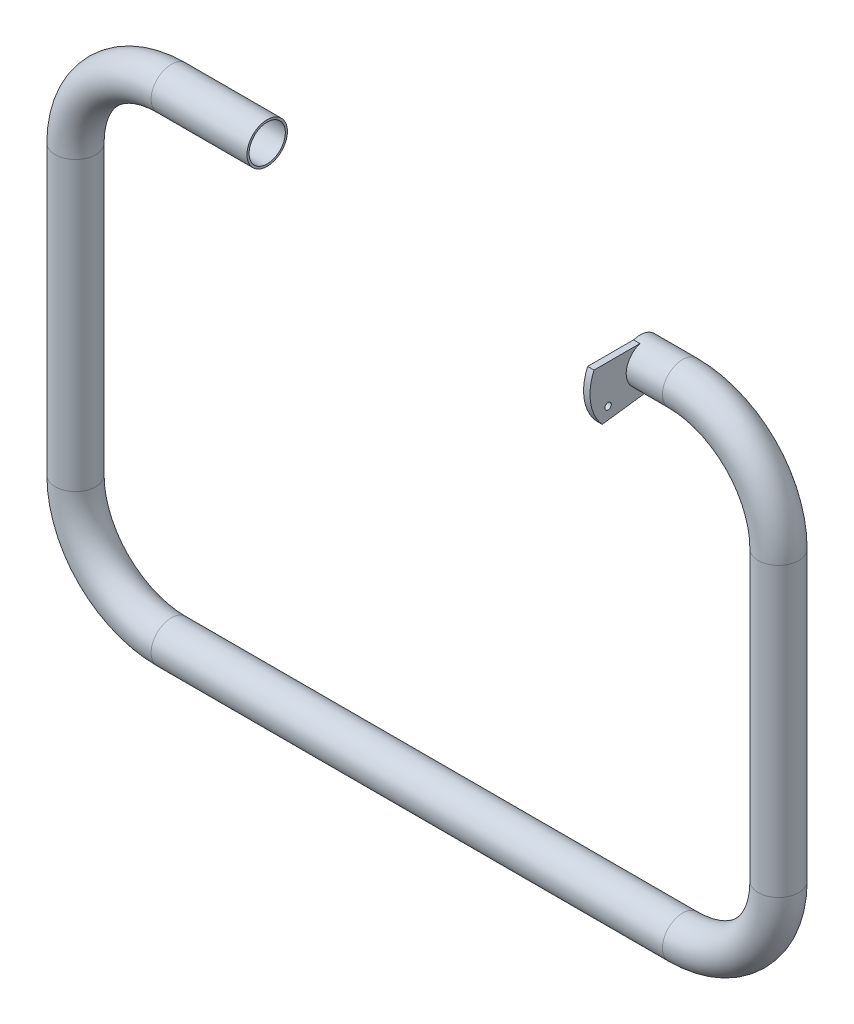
SolidWorks part; units mm, degrees
ref_plane "Face" through (0, 0, 0) normal (0, 0, 1) x (1, 0, 0)
ref_plane "Dessus" through (0, 0, 0) normal (0, 1, 0) x (1, 0, 0)
ref_plane "Droite" through (0, 0, 0) normal (1, 0, 0) x (0, 0, -1)
sketch "Esquisse1" plane through (0, 0, 0) normal (0, 0, 1) x (1, 0, 0)
  line L0 (0, 0) -> (40, 0)
  line L1 (130, -90) -> (130, -360)
  line L2 (40, -450) -> (-440, -450)
  line L3 (-530, -360) -> (-530, -90)
  line L4 (-440, 0) -> (-350, 0)
  arc A0 (40, 0) -> (130, -90) centre (40, -90) cw
  arc A1 (130, -360) -> (40, -450) centre (40, -360) cw
  arc A2 (-440, -450) -> (-530, -360) centre (-440, -360) cw
  arc A3 (-530, -90) -> (-440, 0) centre (-440, -90) cw
  point P9 (130, 0)
  point P12 (130, -450)
  point P15 (-530, -450)
  point P18 (-530, 0)
  dimension "D5" = 90
  dimension "D6" = 90
  dimension "D7" = 90
  dimension "D8" = 90
  dimension "D1" = 450
  dimension "D2" = 660
  dimension "D3" = 180
  dimension "D4" = 130
sketch "Esquisse2" plane through (0, 0, 0) normal (1, 0, 0) x (0, 0, -1)
  circle A0 centre (0, 0) radius 17
  dimension "D1" = 34
sweep "Base-Balayage-Mince" add profiles "Esquisse2" path "Esquisse1" parameters "D1"=2
sketch "Esquisse4" plane through (0, 0, 0) normal (-1, 0, 0) x (0, 0, 1)
  line L0 (-18, 0) -> (-19.5, 0)
  line L1 (-19.5, 0) -> (-19.5, -22)
  line L3 (-19.5, -22) -> (41.541, -30)
  line L4 (41.541, 18) -> (41.541, -30) construction
  line L5 (0, 18) -> (49.2432, 18)
  arc A0 (-18, 0) -> (0, 18) centre (0, 0) ccw
  arc A1 (41.541, -30) -> (49.2432, 18) centre (8, 0) ccw
  circle A2 centre (36, -18) radius 3
  dimension "D1" = 36
  dimension "D2" = 90
  dimension "D7" = 6
  dimension "D3" = 8
  dimension "D4" = 48
  dimension "D5" = 22
  dimension "D6" = 1.5
  dimension "D8" = 36
  dimension "D9" = 18
  dimension "D10" = 61.041
extrude "Boss.-Extru.1" add sketch "Esquisse4" against normal blind 6
